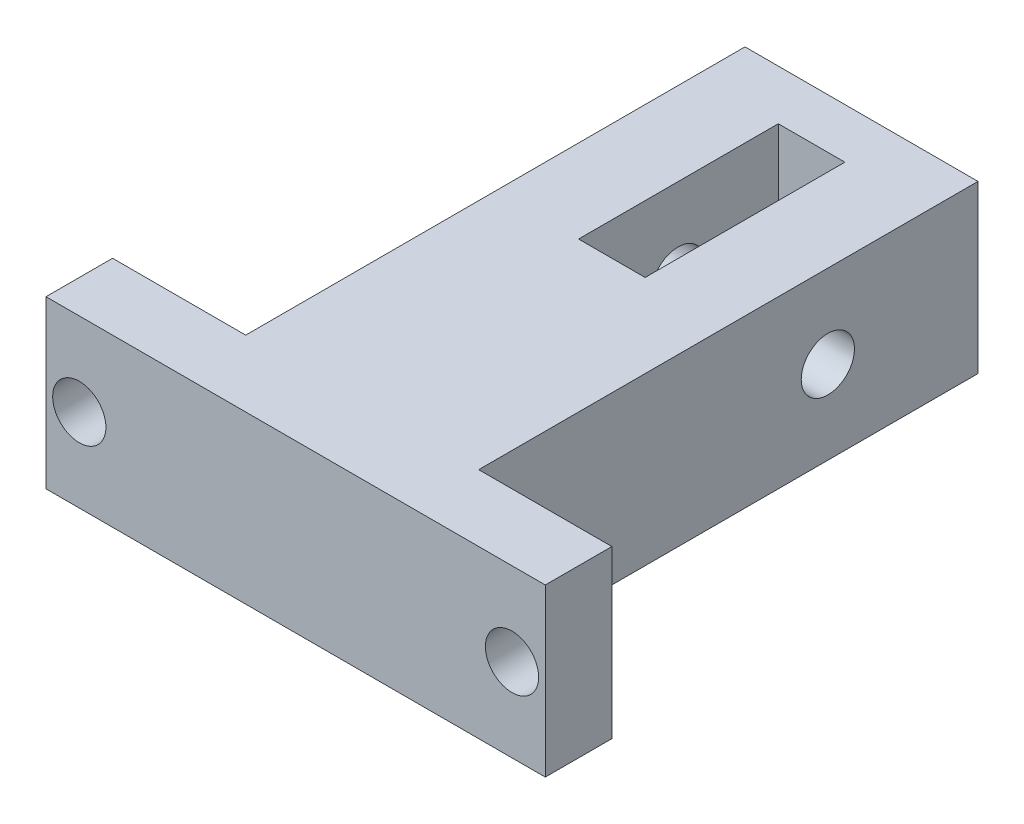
SolidWorks part; units mm, degrees
ref_plane "Front Plane" through (0, 0, 0) normal (0, 0, 1) x (1, 0, 0)
ref_plane "Top Plane" through (0, 0, 0) normal (0, 1, 0) x (1, 0, 0)
ref_plane "Right Plane" through (0, 0, 0) normal (1, 0, 0) x (0, 0, -1)
sketch "Sketch2" plane through (0, 0, 0) normal (0, 1, 0) x (1, 0, 0)
  line L0 (-15, 0) -> (15, 0)
  line L1 (15, 0) -> (15, 4)
  line L2 (15, 4) -> (7, 4)
  line L3 (7, 4) -> (7, 31)
  line L4 (2, 31) -> (-2, 31)
  line L5 (2, 31) -> (2, 19)
  line L6 (2, 19) -> (-2, 19)
  line L7 (-2, 19) -> (-2, 31)
  line L9 (-7, 31) -> (-7, 4)
  line L10 (-7, 4) -> (-15, 4)
  line L11 (-15, 4) -> (-15, 0)
  line L12 (7, 31) -> (7, 34)
  line L13 (7, 34) -> (-7, 34)
  line L14 (-7, 34) -> (-7, 31)
  point P4 (0, 0)
extrude "Boss-Extrude1" add sketch "Sketch2" along normal blind 10
sketch "Sketch3" plane through (0, 0, 0) normal (0, 0, 1) x (1, 0, 0)
  line L6 (0, 0) -> (0, 10) construction
  line L7 (2, 10) -> (-2, 10) construction
  circle A0 centre (13, 5) radius 1.6
  circle A1 centre (-13, 5) radius 1.6
extrude "Cut-Extrude1" cut sketch "Sketch3" along normal blind 1 and the other way blind 6
sketch "Sketch4" plane through (0, 0, 0) normal (1, 0, 0) x (0, 0, -1)
  circle A0 centre (24.9781, 5) radius 1.6
extrude "Cut-Extrude2" cut sketch "Sketch4" against normal blind 9 and the other way blind 9
